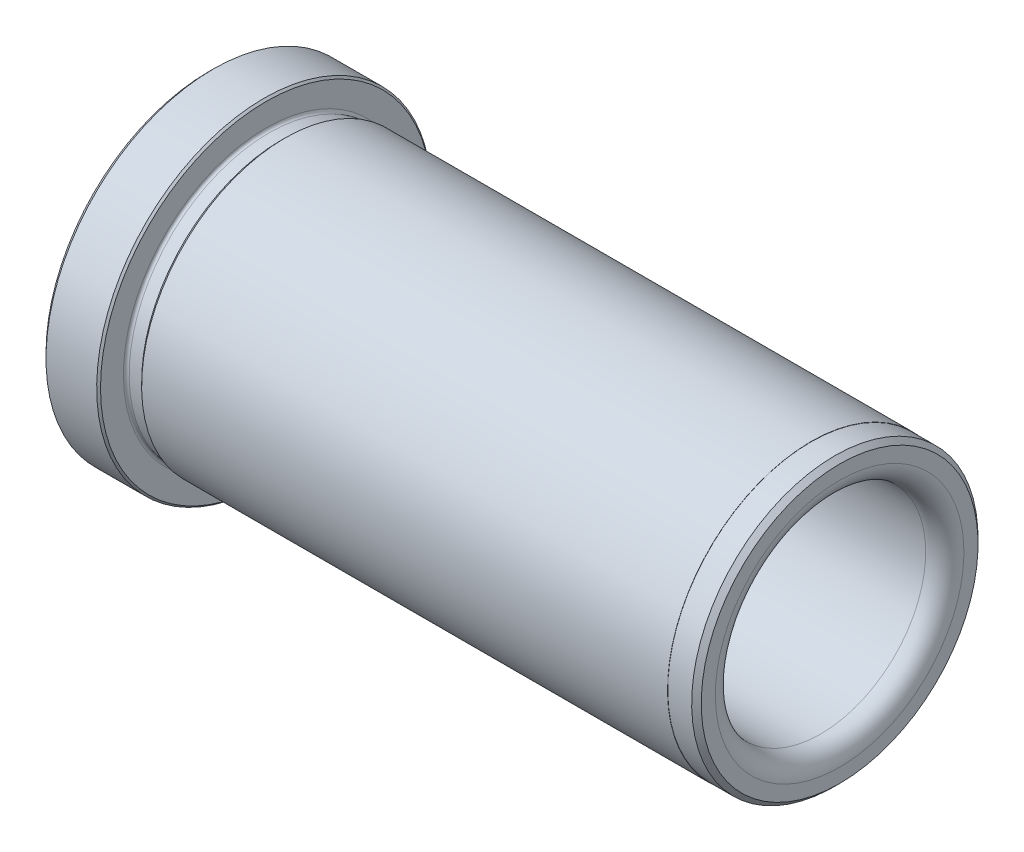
SolidWorks part; units mm, degrees
ref_plane "Front Plane" through (0, 0, 0) normal (0, 0, 1) x (1, 0, 0)
ref_plane "Top Plane" through (0, 0, 0) normal (0, 1, 0) x (1, 0, 0)
ref_plane "Right Plane" through (0, 0, 0) normal (1, 0, 0) x (0, 0, -1)
sketch "Sketch1" plane through (0, 0, 0) normal (0, 0, 1) x (1, 0, 0)
  line L0 (33, 14.975) -> (30, 14.975)
  line L1 (30, 15) -> (-25, 15)
  line L2 (30, 14.975) -> (30, 15)
  line L6 (-27, 17.5) -> (-27, 14.9)
  line L7 (-27, 17.5) -> (-33, 17.5)
  line L8 (-33, 17.5) -> (-33, 0)
  line L13 (33, 14.975) -> (33, 0)
  line L14 (33, 0) -> (-33, 0) construction
  line L15 (33, 0) -> (-33, 0)
  line L16 (-25, 15) -> (-25.4, 14.6)
  line L17 (-25.4, 14.6) -> (-26.7, 14.6)
  arc A0 (-26.7, 14.6) -> (-27, 14.9) centre (-26.7, 14.9) cw
  point P16 (0, 0)
  dimension "D5" = 0.025
  dimension "D1" = 0.3
  dimension "D2" = 135
  dimension "OD" = 30
  dimension "D3" = 0.4
  dimension "T" = 6
  dimension "HeadDia" = 35
  dimension "S" = 66
  dimension "HeadGap" = 2
  dimension "LeadLength" = 3
revolve "Revolve1" add sketch "Sketch1" angle 360 about L14
sketch "Sketch2" plane through (33, 0, 0) normal (1, 0, 0) x (0, 0, -1)
  circle A0 centre (0, 0) radius 11
  circle A1 centre (0, 0) radius 15 construction
  dimension "ID" = 22
extrude "Extrude1" cut sketch "Sketch2" against normal blind 76
sketch "Sketch4" [suppressed] plane through (7, 0, 0) normal (1, 0, 0) x (0, 0, -1)
  circle A0 centre (0, 0) radius 21.01
  circle A2 centre (0, 0) radius 21 construction
  dimension "D1" = 0.01
extrude "Extrude3" [suppressed] cut sketch "Sketch4" against normal through all
fillet "Fillet2" radius 2 1 edges at (33, 11, 0)
chamfer "Chamfer3" distance 0.5 angle 45 3 edges at (33, 14.975, 0) (-33, -11, 0) (-33, 17.5, 0)
chamfer "Chamfer4" distance 0.2 angle 45 1 edges at (-27, 17.5, 0)
